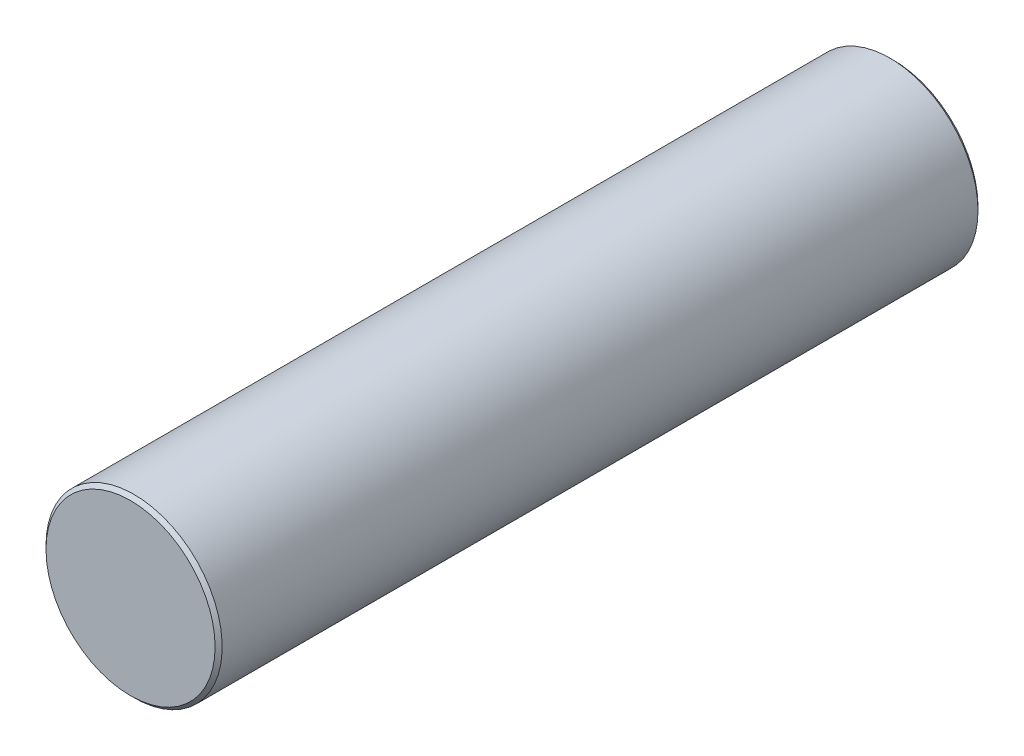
SolidWorks part; units mm, degrees
ref_plane "Front Plane" through (0, 0, 0) normal (0, 0, 1) x (1, 0, 0)
ref_plane "Top Plane" through (0, 0, 0) normal (0, 1, 0) x (1, 0, 0)
ref_plane "Right Plane" through (0, 0, 0) normal (1, 0, 0) x (0, 0, -1)
sketch "Sketch1" plane through (0, 0, 0) normal (0, 0, 1) x (1, 0, 0)
  circle A0 centre (0, 0) radius 6.35 construction
sketch "Sketch2" plane through (0, 0, 0) normal (1, 0, 0) x (0, 0, -1)
  line L0 (63.5, 0) -> (-63.5, 0) construction
  point P0 (-50.8, 0)
  point P3 (0, 0)
  point P4 (50.8, 0)
  point P6 (-44.45, 0)
  point P7 (44.45, 0)
sketch "Sketch3" plane through (0, 0, 0) normal (0, 0, 1) x (1, 0, 0)
  circle A0 centre (0, 0) radius 6.35 construction
  circle A1 centre (0, 0) radius 6.35
extrude "Boss-Extrude1" add sketch "Sketch3" along normal blind 55
chamfer "Chamfer1" distance 0.254 angle 45 2 edges at (6.35, 0, 55) (6.35, 0, 0)
equation "\"D1@Chamfer1\"=\"Diameter@Sketch1\"*.02"
equation "\"D1@Sketch2\"=\"D2@Sketch2\""
equation "\"D2@Sketch2\"=\"Length@Sketch2\"*.1"
equation "\"D3@Sketch2\"=\"Length@Sketch2\"*.15"
equation "\"D4@Sketch2\"=\"D3@Sketch2\""
